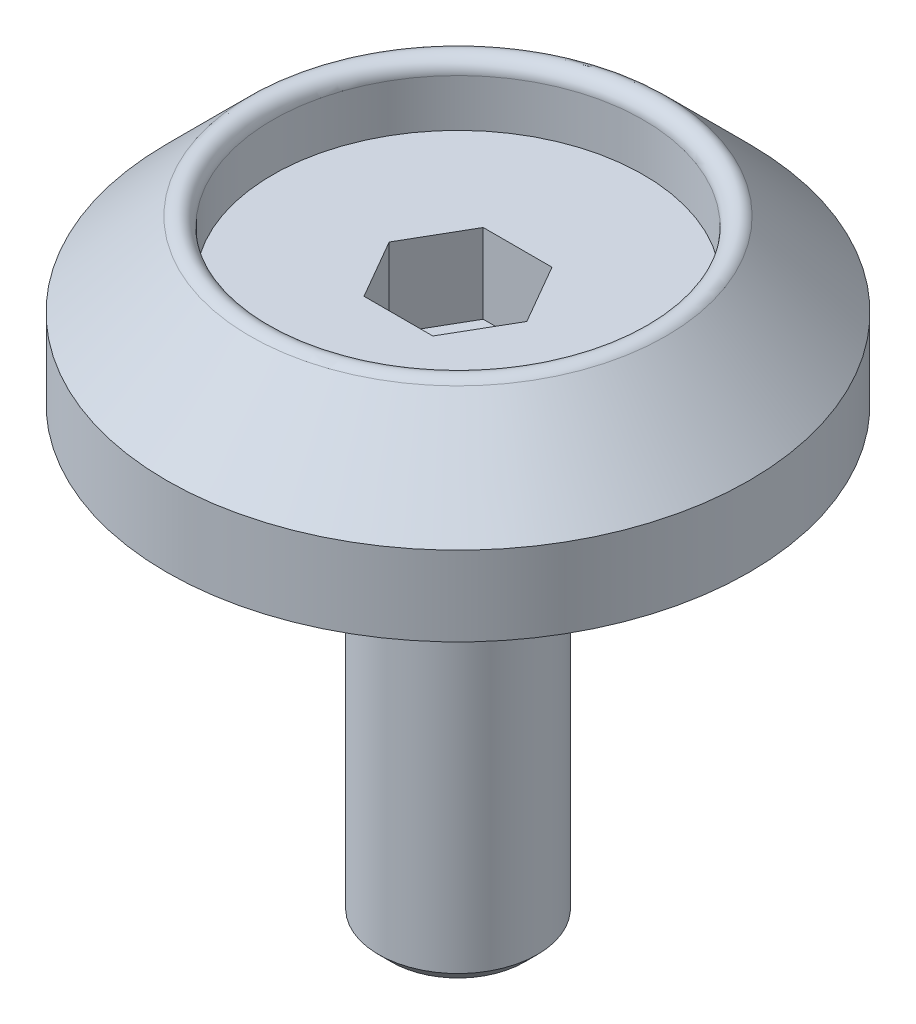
SolidWorks part; units mm, degrees
ref_plane "Face" through (0, 0, 0) normal (0, 0, 1) x (1, 0, 0)
ref_plane "Dessus" through (0, 0, 0) normal (0, 1, 0) x (1, 0, 0)
ref_plane "Droite" through (0, 0, 0) normal (1, 0, 0) x (0, 0, -1)
sketch "Esquisse1" plane through (0, 0, 0) normal (0, 0, 1) x (1, 0, 0)
  line L0 (0, 0) -> (1.25, 0)
  line L1 (1.5, 0.25) -> (1.5, 8.5)
  line L2 (1.5, 8.5) -> (5.5, 8.5)
  line L3 (5.5, 8.5) -> (5.5, 10)
  line L4 (5.5, 10) -> (3.9268, 11.5732)
  line L5 (0, 10.5) -> (3.5, 10.5)
  line L6 (0, 10.5) -> (0, 0)
  line L7 (3.5, 10.5) -> (3.5, 11.3964)
  line L8 (0, -3.1203) -> (0, 14.2384) construction
  line L9 (1.25, 0) -> (1.5, 0.25)
  arc A0 (3.9268, 11.5732) -> (3.5, 11.3964) centre (3.75, 11.3964) ccw
  point P1 (1.5, 0)
  point P10 (3.5, 12)
  dimension "D8" = 0.25
  dimension "D1" = 3.5
  dimension "D2" = 5.5
  dimension "D3" = 1.5
  dimension "D4" = 8.5
  dimension "D5" = 1.5
  dimension "D6" = 45
  dimension "D7" = 1.5
  dimension "D11" = 0.25
revolve "Base-Révolution" add sketch "Esquisse1" angle 360 about L8
sketch "Esquisse2" plane through (0, 10.5, 0) normal (0, 1, 0) x (-1, 0, 0)
  line L0 (-0.6495, 1.125) -> (0.6495, 1.125)
  line L1 (0.6495, 1.125) -> (1.299, 0)
  line L2 (1.299, 0) -> (0.6495, -1.125)
  line L3 (0.6495, -1.125) -> (-0.6495, -1.125)
  line L4 (-0.6495, -1.125) -> (-1.299, 0)
  line L5 (-1.299, 0) -> (-0.6495, 1.125)
  circle A0 centre (0, 0) radius 1.125 construction
  dimension "D1" = 2.25
  dimension "D2" = 120
  dimension "D3" = 120
  dimension "D4" = 120
  dimension "D5" = 120
  dimension "D6" = 120
extrude "Enlèv. mat.-Extru.1" cut sketch "Esquisse2" against normal blind 1.5
sketch "Esq_WRNL_Compact001" plane through (0, 0, 0) normal (0, 0, 1) x (1, 0, 0)
  line L0 (-6.5, -1) -> (-6.5, 12.6464)
  line L1 (6.5, -1) -> (6.5, 12.6464)
  line L2 (-6.5, -1) -> (6.5, -1)
  line L3 (-6.5, 12.6464) -> (6.5, 12.6464)
